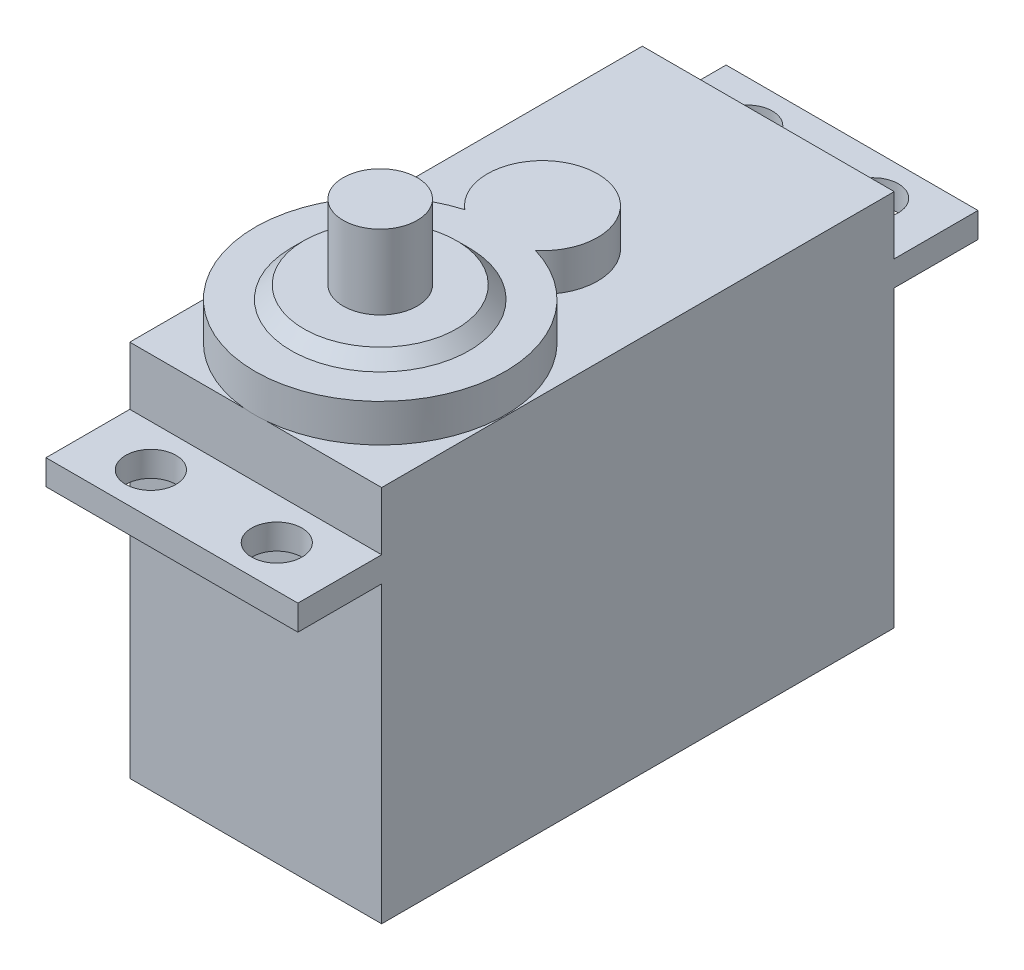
SolidWorks part; units mm, degrees
ref_plane "Front Plane" through (0, 0, 0) normal (0, 0, 1) x (1, 0, 0)
ref_plane "Top Plane" through (0, 0, 0) normal (0, 1, 0) x (1, 0, 0)
ref_plane "Right Plane" through (0, 0, 0) normal (1, 0, 0) x (0, 0, -1)
ref_plane "Plane1" through (10, 0, 0) normal (1, 0, 0) x (0, 0, -1)
sketch "Sketch1" plane through (10, 0, 0) normal (1, 0, 0) x (0, 0, -1)
  line L0 (-27, -15) -> (27, -15)
  line L1 (27, -15) -> (27, 15)
  line L2 (27, 15) -> (-27, 15)
  line L3 (-27, 15) -> (-27, -15)
extrude "Boss-Extrude1" add sketch "Sketch1" against normal blind 20
sketch "Sketch2" plane through (-10, 0, 0) normal (-1, 0, 0) x (0, 0, 1)
  line L0 (20.35, 15) -> (20.35, 10.3785)
  line L1 (20.35, 10.3785) -> (27, 10.3785)
  line L2 (27, 10.3785) -> (27, 15)
  line L3 (27, 15) -> (20.35, 15)
extrude "Cut-Extrude1" cut sketch "Sketch2" against normal through all
sketch "Sketch3" plane through (0, 15, 0) normal (0, 1, 0) x (-1, 0, 0)
  arc A0 (2.8065, 0.9408) -> (-2.8065, 0.9408) centre (0, -2.4204) cw
  arc A1 (-2.8065, 0.9408) -> (2.8065, 0.9408) centre (0, 10.4638) cw
extrude "Boss-Extrude2" add sketch "Sketch3" along normal blind 3
sketch "Sketch4" plane through (-10, 0, 0) normal (-1, 0, 0) x (0, 0, 1)
  line L0 (-20.35, -15) -> (-20.35, 8.3785)
  line L1 (-20.35, 8.3785) -> (-27, 8.3785)
  line L2 (-27, 8.3785) -> (-27, -15)
  line L3 (-27, -15) -> (-20.35, -15)
extrude "Cut-Extrude2" cut sketch "Sketch4" against normal through all
sketch "Sketch5" plane through (-10, 0, 0) normal (-1, 0, 0) x (0, 0, 1)
  line L0 (-20.35, 10.3785) -> (-20.35, 15)
  line L1 (-20.35, 15) -> (-27, 15)
  line L2 (-27, 15) -> (-27, 10.3785)
  line L3 (-27, 10.3785) -> (-20.35, 10.3785)
extrude "Cut-Extrude3" cut sketch "Sketch5" against normal through all
sketch "Sketch6" plane through (-10, 0, 0) normal (-1, 0, 0) x (0, 0, 1)
  line L0 (20.35, 8.3785) -> (20.35, -15)
  line L1 (20.35, -15) -> (27, -15)
  line L2 (27, -15) -> (27, 8.3785)
  line L3 (27, 8.3785) -> (20.35, 8.3785)
extrude "Cut-Extrude4" cut sketch "Sketch6" against normal through all
ref_plane "Plane2" through (0, 0, 10.4638) normal (0, 0, -1) x (-1, 0, 0)
sketch "Sketch7" plane through (0, 0, 10.4638) normal (0, 0, -1) x (-1, 0, 0)
  line L0 (-7.0673, 18) -> (0, 18)
  line L1 (0, 18) -> (0, 24.9)
  line L2 (0, 24.9) -> (-2.9387, 24.9)
  line L3 (-2.9387, 24.9) -> (-2.9387, 19)
  line L4 (-2.9387, 19) -> (-6.0673, 19)
  line L5 (-6.0673, 19) -> (-7.0673, 18)
  line L6 (0, 18) -> (0, 24.9) construction
revolve "Revolve1" add sketch "Sketch7" angle 360 about L6
hole_wizard "Ø4.0 (4) Diameter Hole1" positions "Sketch9" profile "Sketch8" hole size "Ø4.0" standard "ANSI Metric"
sketch "Sketch9" plane through (0, 10.3785, 0) normal (0, 1, 0) x (1, 0, 0)
  point P0 (-5, 23.675)
  point P1 (5, 23.675)
  point P2 (5, -23.675)
  point P3 (-5, -23.675)
sketch "Sketch8" plane through (-5, 10.3785, -23.675) normal (1, 0, 0) x (0, 0, 1)
  line L0 (0, 0) -> (0, 25.3785)
  line L1 (0, 25.3785) -> (2, 25.3785)
  line L2 (2, 25.3785) -> (2, 0)
  line L5 (2, 0) -> (0, 0)
  line L11 (0, -6.35) -> (0, 107.95) construction
  dimension "Thru Hole Dia." = 4
  dimension "Thru Hole Depth" = 25.3785
